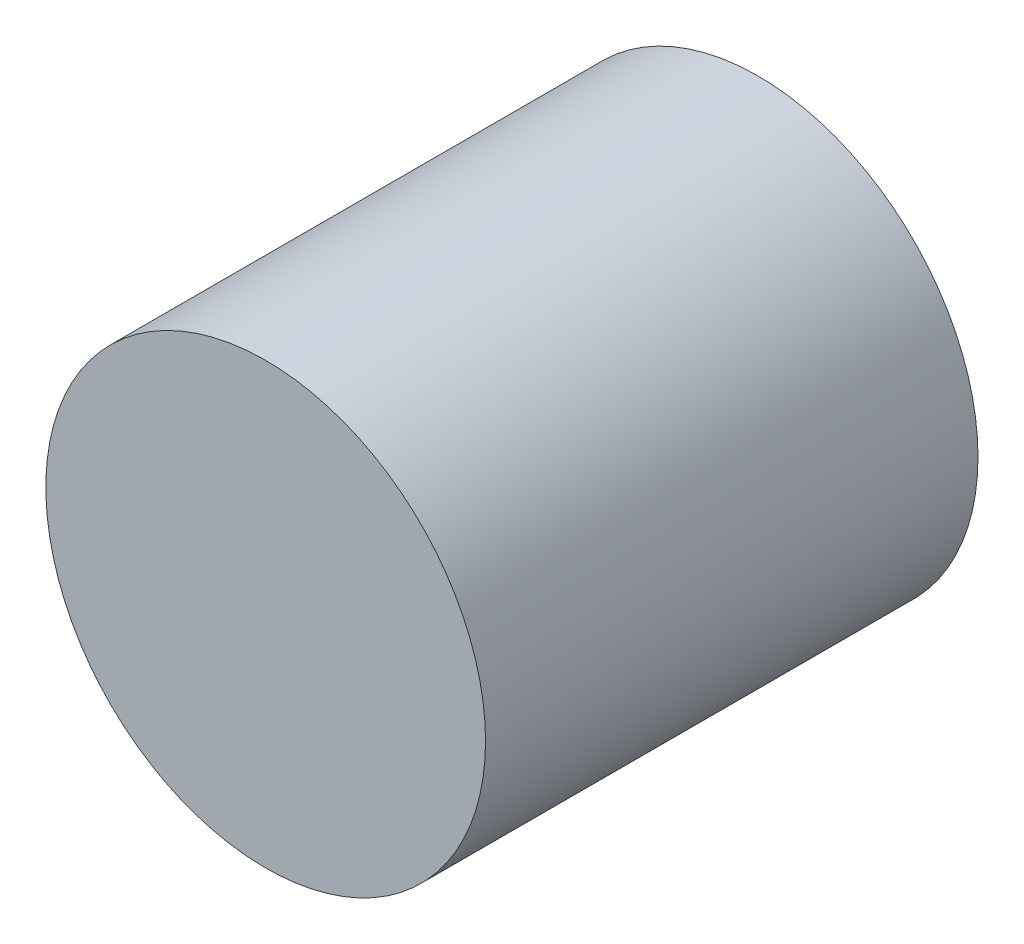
SolidWorks part; units mm, degrees
ref_plane "Plan de face" through (0, 0, 0) normal (0, 0, 1) x (1, 0, 0)
ref_plane "Plan de dessus" through (0, 0, 0) normal (0, 1, 0) x (1, 0, 0)
ref_plane "Plan de droite" through (0, 0, 0) normal (1, 0, 0) x (0, 0, -1)
sketch "Esquisse1" plane through (0, 0, 0) normal (0, 0, 1) x (1, 0, 0)
  circle A0 centre (0, 0) radius 25
  dimension "D1" = 50
extrude "Extrusion1" add sketch "Esquisse1" along normal blind 56
